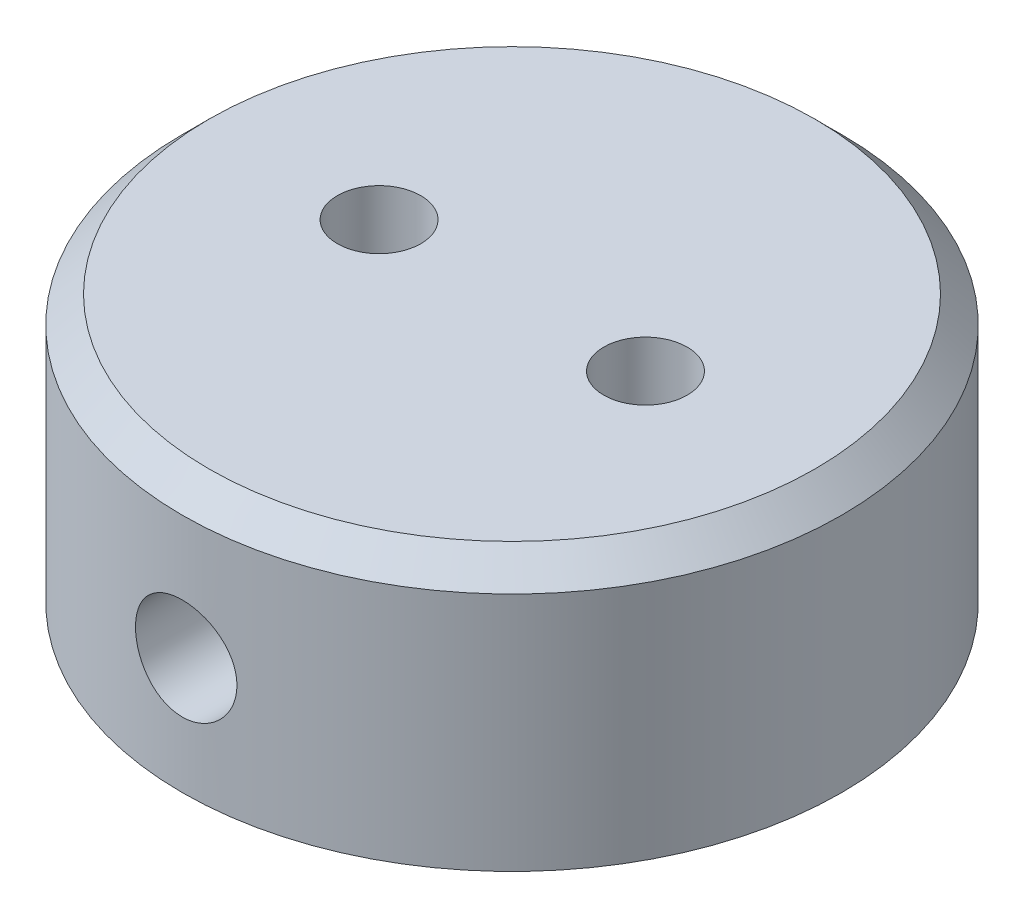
SolidWorks part; units mm, degrees
ref_plane "Front Plane" through (0, 0, 0) normal (0, 0, 1) x (1, 0, 0)
ref_plane "Top Plane" through (0, 0, 0) normal (0, 1, 0) x (1, 0, 0)
ref_plane "Right Plane" through (0, 0, 0) normal (1, 0, 0) x (0, 0, -1)
sketch "Sketch1" plane through (0, 0, 0) normal (0, 1, 0) x (1, 0, 0)
  circle A0 centre (0, 0) radius 31.369
  dimension "D1" = 62.738
extrude "Extrude1" add sketch "Sketch1" along normal blind 25.4
chamfer "Chamfer1" distance 2.54 angle 45 1 edges at (0, 25.4, 31.369)
sketch "Sketch7" plane through (0, 0, 0) normal (0, -1, 0) x (1, 0, 0)
  point P4 (-12.7, 0)
  point P5 (12.7, 0)
sketch "Sketch10" plane through (0, 0, 0) normal (0, 0, 1) x (1, 0, 0)
  circle A0 centre (0, 11.0569) radius 4.826
extrude "Cut-Extrude1" cut sketch "Sketch10" against normal through all and the other way through all
hole_wizard "3/8-16 Tapped Hole1" positions "3DSketch1" profile "Sketch11" tap size "3/8-16" standard "Ansi Inch"
sketch3d "3DSketch1"
  point P4 (-12.4528, 0, 0.1945)
  point P8 (12.7, 0, 0)
sketch "Sketch11" plane through (-12.4528, 0, 0.1945) normal (1, 0, 0) x (0, 0, -1)
  line L0 (0, 0) -> (0, 29.3722)
  line L1 (0, 29.3722) -> (3.9687, 26.9875)
  line L2 (3.9687, 26.9875) -> (3.9687, 0)
  line L5 (3.9687, 0) -> (0, 0)
  line L10 (0, 29.3722) -> (-3.9688, 26.9875) construction
  line L11 (0, -6.35) -> (0, 107.95) construction
  dimension "Tap Drill Dia." = 7.9375
  dimension "Tap Drill Depth" = 26.9875
  dimension "Drill Angle" = 118
